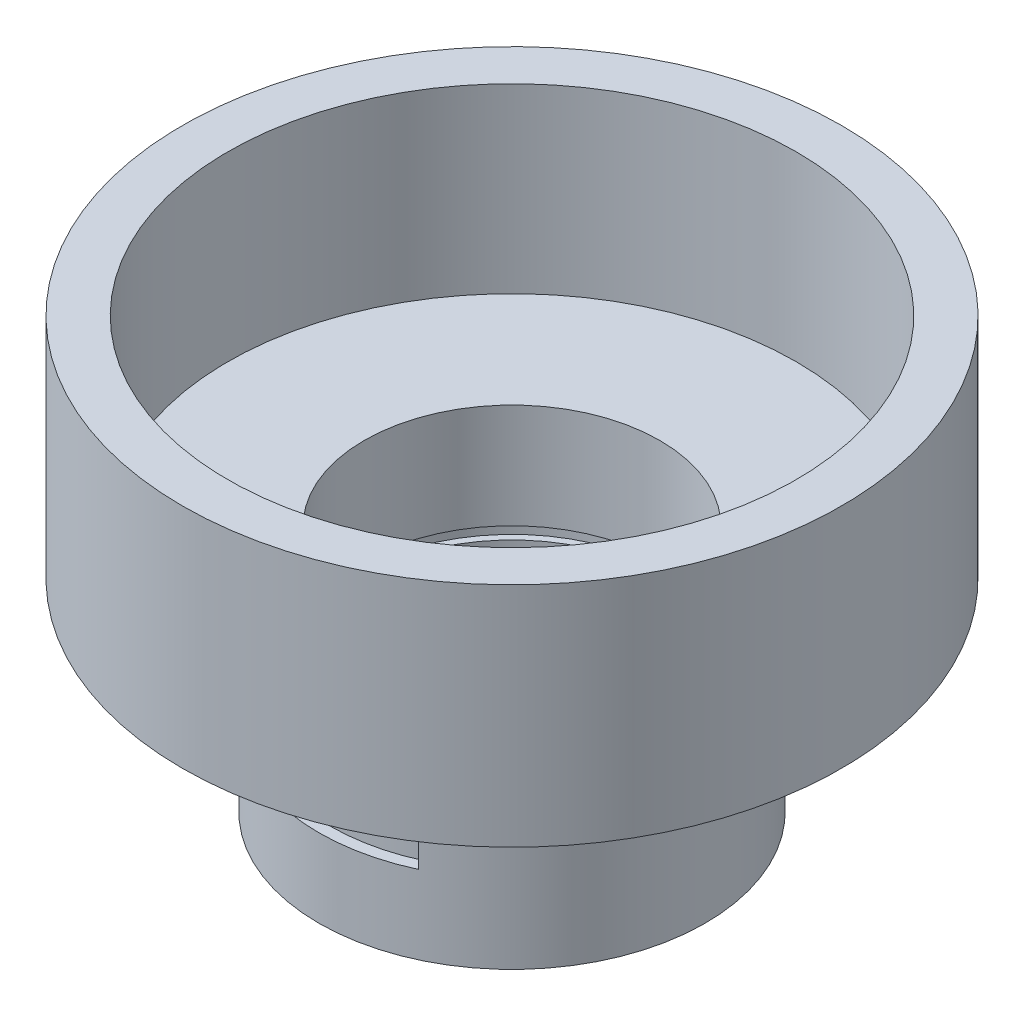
SolidWorks part; units mm, degrees
ref_plane "Plan de face" through (0, 0, 0) normal (0, 0, 1) x (1, 0, 0)
ref_plane "Plan de dessus" through (0, 0, 0) normal (0, 1, 0) x (1, 0, 0)
ref_plane "Plan de droite" through (0, 0, 0) normal (1, 0, 0) x (0, 0, -1)
ref_axis "Axe1" through (0, -55, 0) along (0, 1, 0)
sketch "Esquisse2" plane through (0, 0, 0) normal (0, 0, 1) x (1, 0, 0)
  line L0 (62.5, 75.1827) -> (62.5, 35.1827)
  line L1 (62.5, 35.1827) -> (32.5, 35.1827)
  line L2 (32.5, 35.1827) -> (32.5, 12.1827)
  line L3 (72.5, 75.1827) -> (72.5, 25.1827)
  line L4 (72.5, 25.1827) -> (42.5, 25.1827)
  line L5 (42.5, 25.1827) -> (42.5, -19.3173)
  line L6 (0, -55) -> (0, 55) construction
  line L7 (62.5, 75.1827) -> (72.5, 75.1827)
  line L8 (32.5, -19.3173) -> (42.5, -19.3173)
  line L9 (32.5, 35.1827) -> (32.5, -19.3173) construction
  line L10 (32.5, 12.1827) -> (34, 12.1827)
  line L11 (34, 12.1827) -> (34, 9.4827)
  line L12 (34, 9.4827) -> (32.5, 9.4827)
  line L13 (32.5, 9.4827) -> (32.5, -19.3173)
  dimension "D2" = 62.5
  dimension "D3" = 2.7
  dimension "D4" = 44.5
  dimension "D5" = 40
  dimension "D6" = 23
  dimension "D7" = 1.5
  dimension "D8" = 32.5
  dimension "D1" = 10
revolve "Révolution1" add sketch "Esquisse2" angle 360 about axis through (0, -55, 0) along (0, 1, 0)
sketch "Esquisse3" plane through (0, -19.3173, 0) normal (0, -1, 0) x (1, 0, 0)
  line L1 (-5, -42.5) -> (5, -42.5)
  line L2 (-5, -42.5) -> (-5, -37.5)
  line L3 (-5, -37.5) -> (5, -37.5)
  line L4 (5, -42.5) -> (5, -37.5)
  circle A1 centre (0, 0) radius 42.5 construction
  dimension "D1" = 5
  dimension "D2" = 10
  dimension "D3" = 5
extrude "Enlèv. mat.-Extru.3" cut sketch "Esquisse3" against normal up to surface (44.5 mm away)
ref_plane "Plan1" through (0, 2.9327, 0) normal (0, -1, 0) x (1, 0, 0)
sketch "Esquisse4" plane through (0, 2.9327, 0) normal (0, -1, 0) x (1, 0, 0)
  line L0 (-17.9613, 38.5181) -> (-16.9047, 36.2523)
  line L1 (16.9047, 36.2523) -> (17.9613, 38.5181)
  line L2 (0, 62.9567) -> (0, -56.6066) construction
  arc A0 (17.9613, 38.5181) -> (-17.9613, 38.5181) centre (0, 0) ccw
  arc A1 (16.9047, 36.2523) -> (-16.9047, 36.2523) centre (0, 0) ccw
  dimension "D3" = 80
  dimension "D1" = 50
  dimension "D2" = 25
extrude "Enlèv. mat.-Extru.4" cut sketch "Esquisse4" against normal blind 5 and the other way blind 5
